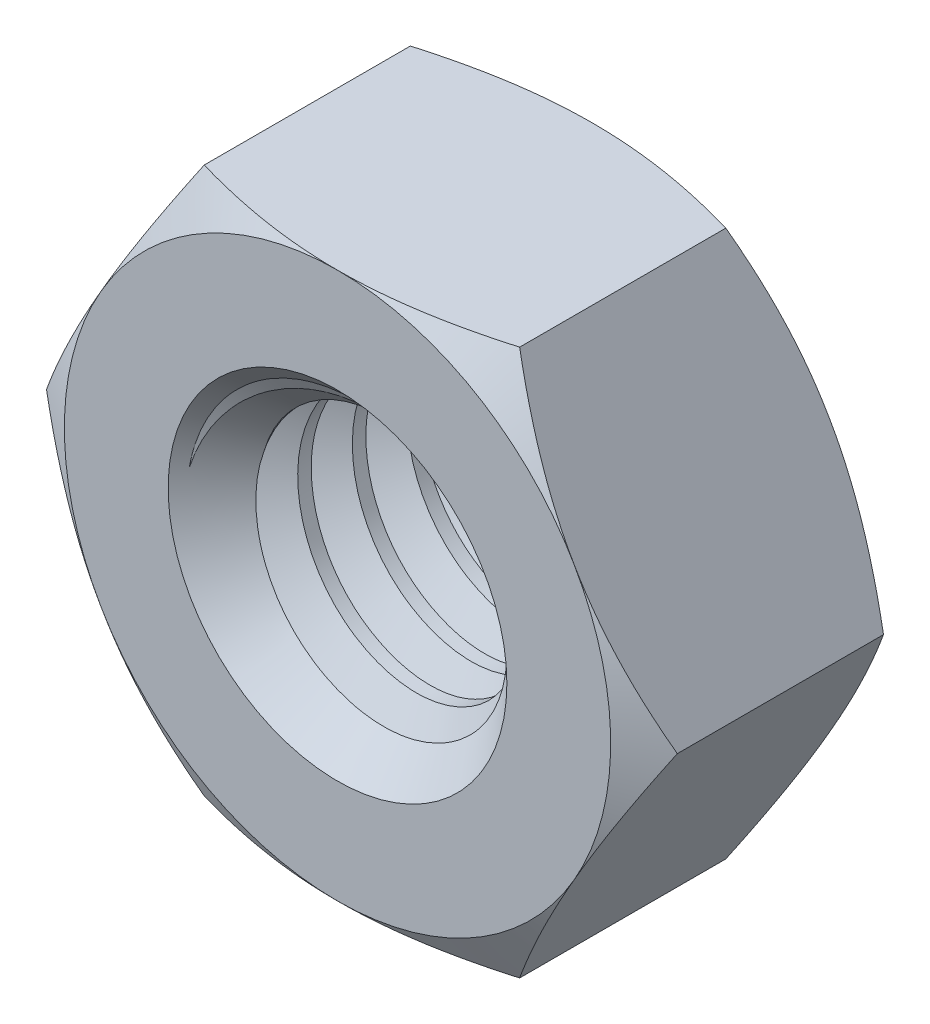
SolidWorks part; units mm, degrees
ref_plane "Front" through (0, 0, 0) normal (0, 0, 1) x (1, 0, 0)
ref_plane "Top" through (0, 0, 0) normal (0, 1, 0) x (1, 0, 0)
ref_plane "Right" through (0, 0, 0) normal (1, 0, 0) x (0, 0, -1)
sketch "Çizim1" plane through (0, 0, 0) normal (0, 0, 1) x (1, 0, 0)
  line L1 (3.4641, 0) -> (1.7321, 3)
  line L2 (1.7321, 3) -> (-1.7321, 3)
  line L3 (-1.7321, 3) -> (-3.4641, 0)
  line L4 (-3.4641, 0) -> (-1.7321, -3)
  line L5 (-1.7321, -3) -> (1.7321, -3)
  line L6 (1.7321, -3) -> (3.4641, 0)
  circle A0 centre (0, 0) radius 3 construction
  dimension "D1" = 6
extrude "Yükseklik-Ekstrüzyon1" add sketch "Çizim1" along normal blind 2.8
sketch "Çizim2" plane through (0, 0, 2.8) normal (0, 0, 1) x (1, 0, 0)
  circle A0 centre (0, 0) radius 3
extrude "Kes-Ekstrüzyon1" cut sketch "Çizim2" against normal blind 2.8 draft 60 flip side to cut
sketch "Çizim3" plane through (0, 0, 0) normal (0, 0, -1) x (-1, 0, 0)
  circle A0 centre (0, 0) radius 3
extrude "Kes-Ekstrüzyon2" cut sketch "Çizim3" against normal blind 2.8 draft 60 flip side to cut
sketch "Çizim4" plane through (0, 0, 0) normal (0, 0, -1) x (-1, 0, 0)
  circle A0 centre (0, 0) radius 1.36
  dimension "D1" = 2.72
extrude "Kes-Ekstrüzyon3" cut sketch "Çizim4" against normal blind 2.8
chamfer "Pah1" distance 0.5 angle 45 2 edges at (-1.36, 0, 2.8) (-1.36, 0, 0)
sketch "Çizim5" plane through (0, 0, 0) normal (0, 0, -1) x (-1, 0, 0)
  circle A0 centre (0, 0) radius 1.36
curve "Helis/Spiral1"
ref_plane "Düzlem1" through (-0.68, -1.1778, 4) normal (0.8639, -0.4988, 0.07) x (0.0607, -0.035, -0.9975)
sketch "Çizim6" plane through (-0.68, -1.1778, 4) normal (0.8639, -0.4988, 0.07) x (0.0607, -0.035, -0.9975)
  line L0 (0.2983, 0.1267) -> (-0.2983, 0.1267)
  line L1 (0, -0.39) -> (0.2983, 0.1267)
  line L3 (-0.2983, 0.1267) -> (0, -0.39)
  line L4 (0, 0.195) -> (-0.3377, 0.195)
  circle A0 centre (0, 0) radius 0.195 construction
  dimension "D1" = 0.39
sweep "Kes-Süpür1" cut profiles "Çizim6" path "Helis/Spiral1"
